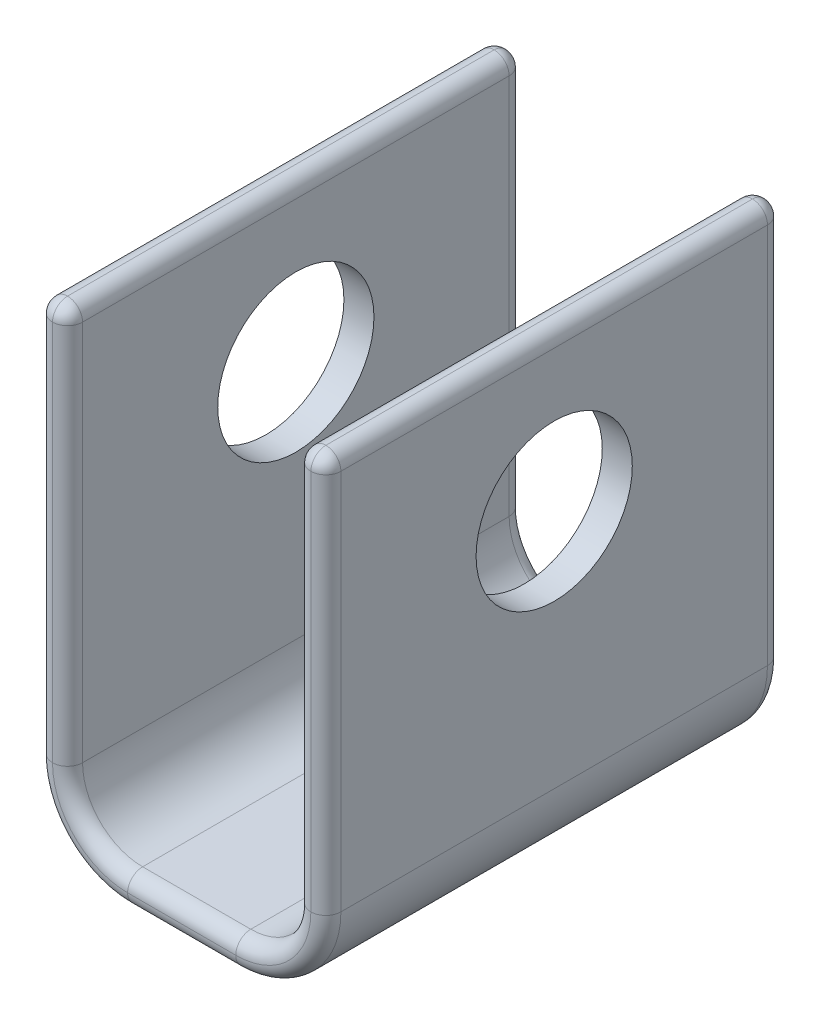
SolidWorks part; units mm, degrees
ref_plane "Front Plane" through (0, 0, 0) normal (0, 0, 1) x (1, 0, 0)
ref_plane "Top Plane" through (0, 0, 0) normal (0, 1, 0) x (1, 0, 0)
ref_plane "Right Plane" through (0, 0, 0) normal (1, 0, 0) x (0, 0, -1)
sketch "Sketch2" plane through (0, 0, 0) normal (0, 0, 1) x (1, 0, 0)
  line L2 (-9.5, 38.0038) -> (-9.5, 5)
  line L7 (55, 0) -> (-55, 0) construction
  line L21 (-4.5, 0) -> (4.5, 0)
  line L22 (9.5, 5) -> (9.5, 38.0038)
  line L23 (0, -55) -> (0, 55) construction
  arc A0 (4.5, 0) -> (9.5, 5) centre (4.5, 5) ccw
  arc A1 (-4.5, 0) -> (-9.5, 5) centre (-4.5, 5) cw
  point P10 (9.5, 0)
  point P13 (-9.5, 0)
  dimension "D4" = 5
  dimension "D1" = 38.0038
  dimension "D2" = 19
  dimension "D3" = 9.5
extrude "Extrude-Thin1" add sketch "Sketch2" along normal mid plane 38 thin
fillet "Fillet5" radius 1.25 24 edges at (9.5, 21.5019, -19) (8.0355, 1.4645, -19) (0, 0, -19) (-8.0355, 1.4645, -19) (-12, 21.5019, -19) (-9.8033, -0.3033, -19) (0, -2.5, -19) (9.8033, -0.3033, -19) (-12, 21.5019, 19) (-9.8033, -0.3033, 19) (0, -2.5, 19) (9.8033, -0.3033, 19) (9.5, 21.5019, 19) (8.0355, 1.4645, 19) (0, 0, 19) (-8.0355, 1.4645, 19) (-9.5, 38.0038, 0) (-12, 38.0038, 0) (12, 38.0038, 0) (9.5, 38.0038, 0) (-9.5, 21.5019, -19) (12, 21.5019, -19) (12, 21.5019, 19) (-9.5, 21.5019, 19)
sketch "Sketch3" plane through (12, 0, 0) normal (1, 0, 0) x (0, 0, -1)
  line L0 (0, 13.2) -> (0, -13.2) construction
  line L1 (-17.75, 38.0038) -> (17.75, 38.0038) construction
  circle A0 centre (0, 25.0038) radius 6.5
  dimension "D1" = 13
  dimension "D2" = 13
extrude "Cut-Extrude1" cut sketch "Sketch3" against normal through all
